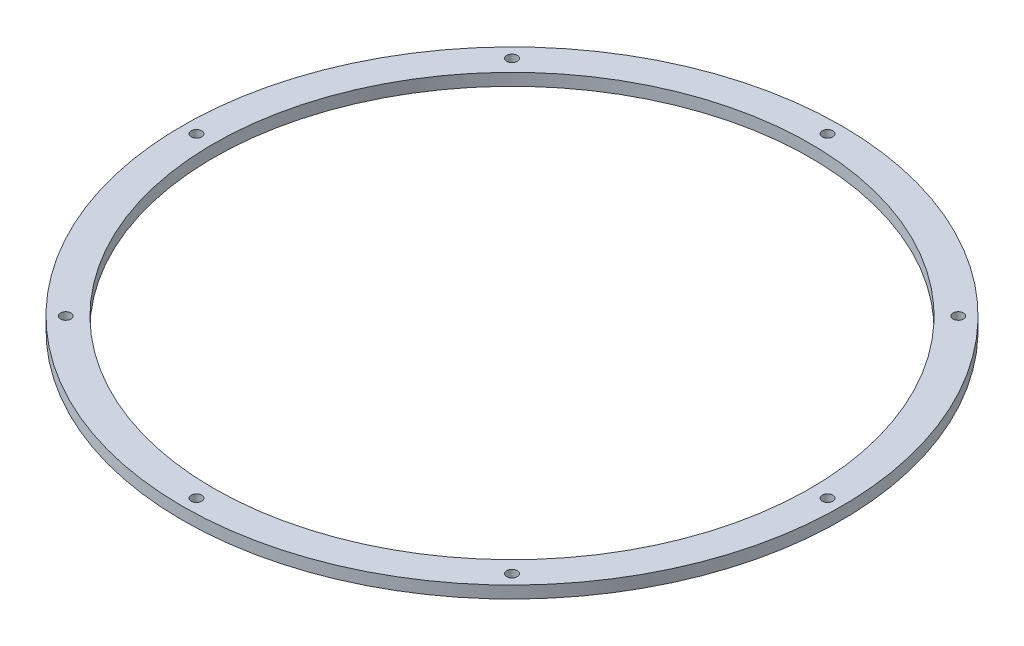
SolidWorks part; units mm, degrees
ref_plane "Front" through (0, 0, 0) normal (0, 0, 1) x (1, 0, 0)
ref_plane "Top" through (0, 0, 0) normal (0, 1, 0) x (1, 0, 0)
ref_plane "Right" through (0, 0, 0) normal (1, 0, 0) x (0, 0, -1)
sketch "Sketch1" plane through (0, 0, 0) normal (0, 1, 0) x (1, 0, 0)
  circle A0 centre (0, 0) radius 134.62
  circle A1 centre (0, 0) radius 121.92
  dimension "D1" = 269.24
  dimension "D2" = 243.84
extrude "Boss-Extrude1" add sketch "Sketch1" along normal blind 4.953
ref_plane "Center Plane" through (0, 2.4765, 0) normal (0, 1, 0) x (1, 0, 0)
hole_wizard "M4 Clearance Hole1" positions "Sketch2" profile "Sketch3" hole size "M4" standard "ANSI Metric"
sketch "Sketch2" plane through (0, 4.953, 0) normal (0, 1, 0) x (1, 0, 0)
  point P0 (0, 128.905)
  dimension "D1" = 128.905
sketch "Sketch3" plane through (0, 4.953, -128.905) normal (1, 0, 0) x (0, 0, 1)
  line L0 (0, 0) -> (0, 4.953)
  line L1 (0, 4.953) -> (2.15, 4.953)
  line L2 (2.15, 4.953) -> (2.15, 0)
  line L5 (2.15, 0) -> (0, 0)
  line L11 (0, -6.35) -> (0, 107.95) construction
  dimension "Thru Hole Dia." = 4.3
  dimension "Thru Hole Depth" = 4.953
pattern_circular "CirPattern1" count 8 over 360 about axis through (0, 0, 0) along (0, 1, 0) of "M4 Clearance Hole1"
